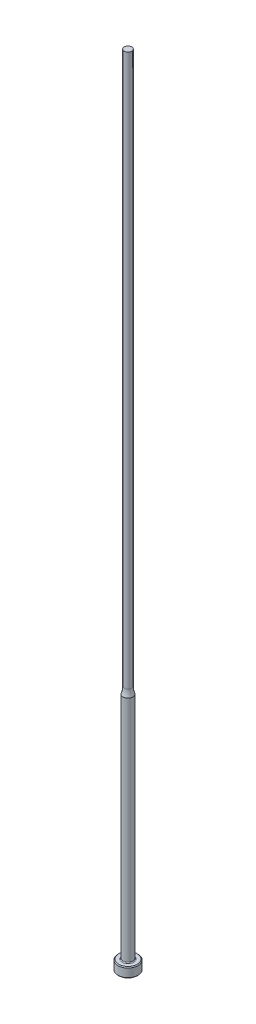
SolidWorks part; units mm, degrees
ref_plane "Front Plane" through (0, 0, 0) normal (0, 0, 1) x (1, 0, 0)
ref_plane "Top Plane" through (0, 0, 0) normal (0, 1, 0) x (1, 0, 0)
ref_plane "Right Plane" through (0, 0, 0) normal (1, 0, 0) x (0, 0, -1)
sketch "Sketch1" plane through (0, 0, 0) normal (0, 0, 1) x (1, 0, 0)
  line L0 (0, 259.9588) -> (0, -15.1925) construction
  line L1 (0, 0) -> (-3.175, 0)
  line L2 (-3.175, 0) -> (-3.175, 3.175)
  line L3 (-3.175, 3.175) -> (-1.5875, 3.175)
  line L4 (-1.19, 78.4114) -> (-1.19, 254)
  line L5 (-1.19, 254) -> (0, 254)
  line L6 (0, 254) -> (0, 0)
  line L7 (-1.5875, 3.175) -> (-1.5875, 76.2)
  arc A0 (-1.5875, 76.2) -> (-1.19, 78.4114) centre (-7.54, 78.4114) ccw
  point P13 (-1.5875, 0)
  dimension "D1" = 6.35
  dimension "L" = 254
  dimension "D2" = 3.175
  dimension "H" = 6.35
  dimension "T" = 3.175
  dimension "D" = 2.38
  dimension "S" = 76.2
revolve "Revolve1" add sketch "Sketch1" angle 360 about L0
chamfer "Chamfer1" distance 0.254 angle 45 2 edges at (0, 3.175, 3.175) (0, 0, 3.175)
fillet "Fillet1" radius 0.254 1 edges at (0, 3.175, 1.5875)
